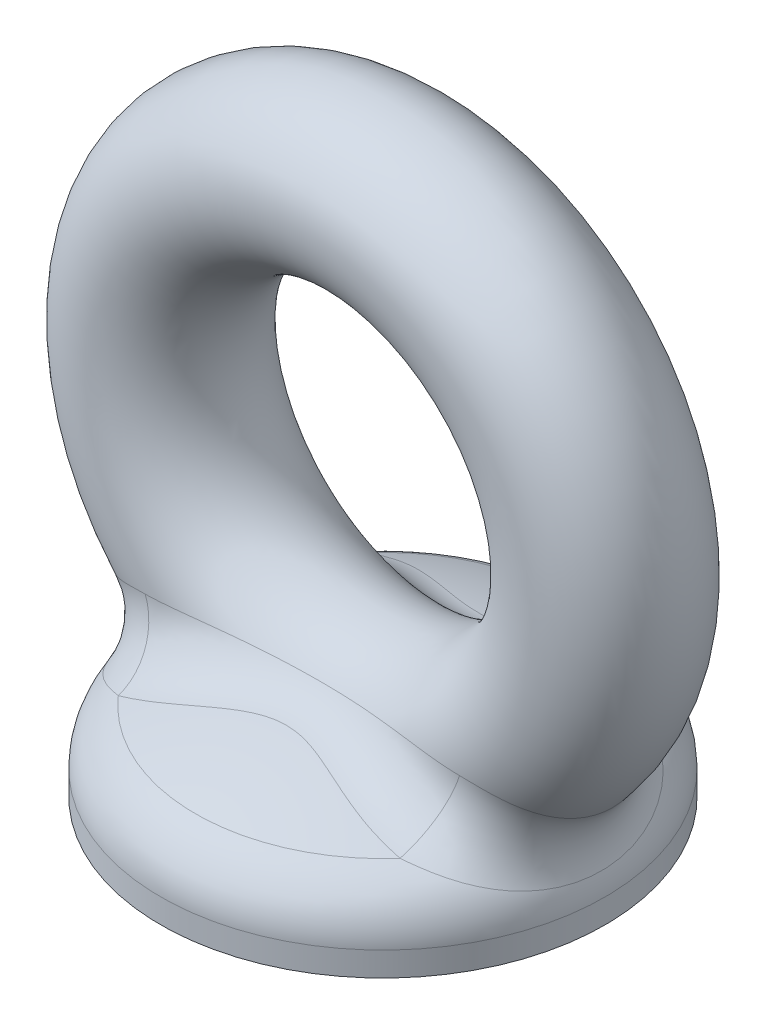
SolidWorks part; units mm, degrees
ref_plane "Front Plane" through (0, 0, 0) normal (0, 0, 1) x (1, 0, 0)
ref_plane "Top Plane" through (0, 0, 0) normal (0, 1, 0) x (1, 0, 0)
ref_plane "Right Plane" through (0, 0, 0) normal (1, 0, 0) x (0, 0, -1)
sketch "Sketch1" plane through (0, 0, 0) normal (0, 0, 1) x (1, 0, 0)
  line L0 (0, 0) -> (34.925, 0)
  line L1 (34.925, 0) -> (34.925, 9.525)
  line L2 (0, 0) -> (0, 19.05) construction
  line L3 (0, 0) -> (0, 19.05)
  arc A0 (0, 19.05) -> (34.925, 9.525) centre (0, -49.7417) cw
  dimension "D1" = 69.85
  dimension "D2" = 19.05
  dimension "D3" = 9.525
revolve "Revolve1" add sketch "Sketch1" angle 360 about L2
fillet "Fillet1" radius 9.525 1 edges at (0, 9.525, -34.925)
sketch "Sketch2" plane through (0, 0, 0) normal (1, 0, 0) x (0, 0, -1)
  line L0 (-34.925, 0) -> (34.925, 0) construction
  line L1 (-32.1066, 47.625) -> (32.1066, 47.625) construction
  line L2 (0, 82.55) -> (0, 0) construction
  circle A0 centre (0, 82.55) radius 12.7
  point P7 (0, 47.625)
  dimension "D2" = 25.4
  dimension "D1" = 69.85
  dimension "D3" = 44.45
revolve "Revolve2" add sketch "Sketch2" angle 360 about L1
fillet "Fillet2" radius 9.525 4 edges at (-31.0215, 11.4943, 0.3189) (31.0215, 11.4943, -0.3189) (4.0138, 17.9303, -11.6913) (-4.0138, 17.9303, 11.6913)
